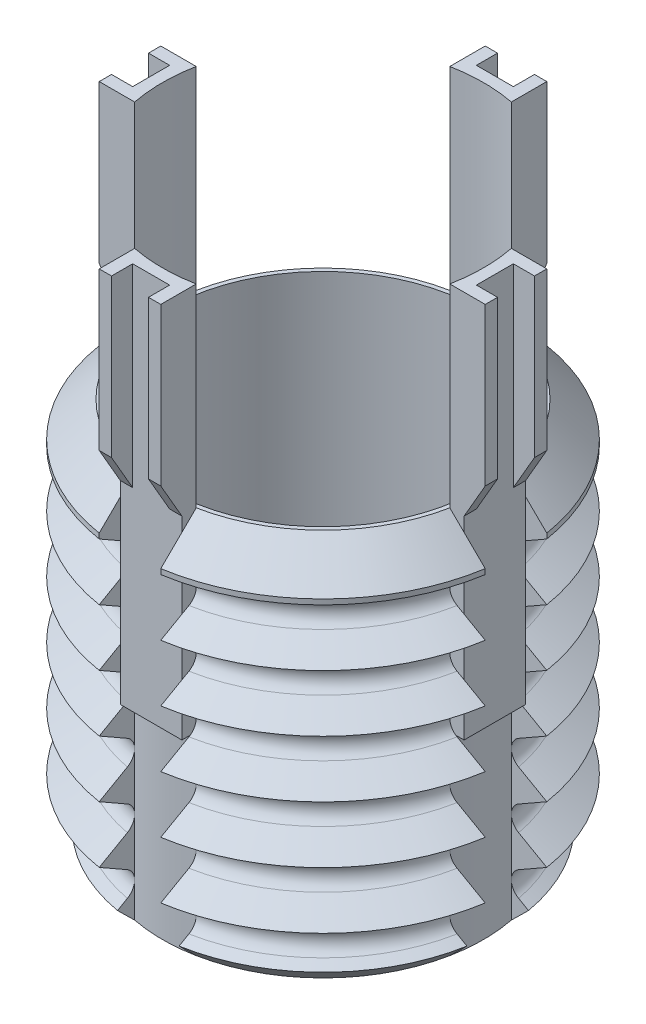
SolidWorks part; units mm, degrees
ref_plane "Front Plane" through (0, 0, 0) normal (0, 0, 1) x (1, 0, 0)
ref_plane "Top Plane" through (0, 0, 0) normal (0, 1, 0) x (1, 0, 0)
ref_plane "Right Plane" through (0, 0, 0) normal (1, 0, 0) x (0, 0, -1)
sketch "Sketch1" plane through (0, 0, 0) normal (0, 1, 0) x (1, 0, 0)
  circle A0 centre (0, 0) radius 7.9375
  circle A1 centre (0, 0) radius 6.35
  dimension "D1" = 12.7
  dimension "D2" = 15.875
extrude "Boss-Extrude1" add sketch "Sketch1" along normal mid plane 15.75
sketch "Sketch2" plane through (0, 7.875, 0) normal (0, 1, 0) x (1, 0, 0)
  circle A0 centre (0, 0) radius 6.52
  dimension "D1" = 13.04
extrude "Cut-Extrude1" cut sketch "Sketch2" against normal through all draft 45 flip side to cut
mirror "Mirror1" about plane through (0, 0, 0) normal (0, 1, 0) of "Cut-Extrude1"
sketch "Sketch3" plane through (0, 7.875, 0) normal (0, 1, 0) x (1, 0, 0)
  line L0 (-7.9375, 0) -> (-7.9375, 1.25)
  line L1 (-7.9375, 1.25) -> (-6.3991, 1.25)
  line L2 (-7.9375, 0) -> (-7.9375, -1.25)
  line L3 (-7.9375, -1.25) -> (-6.3991, -1.25)
  arc A0 (-6.3991, 1.25) -> (-6.3991, -1.25) centre (0, 0) ccw
  circle A1 centre (0, 0) radius 6.52 construction
  circle A2 centre (0, 0) radius 7.9375 construction
  dimension "D1" = 2.5
extrude "Cut-Extrude2" cut sketch "Sketch3" against normal through all
sketch "Sketch4" plane through (0, 0, 0) normal (0, 0, 1) x (1, 0, 0)
  line L1 (7.9375, -6.4575) -> (7.9375, -7.6125)
  line L3 (7.9375, -7.6125) -> (6.8115, -6.9624)
  line L6 (6.8115, -5.9526) -> (7.9375, -5.3025)
  line L10 (7.9375, -6.4575) -> (7.9375, 6.4575) construction
  line L12 (7.9375, -5.3025) -> (7.9375, -6.4575)
  arc A1 (6.8115, -6.9624) -> (6.8115, -5.9526) centre (7.103, -6.4575) cw
  point P5 (6.52, -7.875)
  point P9 (6.52, -6.4575)
  dimension "D2" = 60
  dimension "D1" = 2.31
revolve "Cut-Revolve1" cut sketch "Sketch4" angle 360 about axis through (0, 7.875, 0) along (0, -1, 0)
pattern_linear "LPattern1" count 6 spacing 2.31 along (0, 1, 0) of "Cut-Revolve1"
sketch "Sketch5" plane through (0, 7.875, 0) normal (0, -1, 0) x (1, 0, 0)
  line L0 (-6.3991, 1.25) -> (-7.8385, 1.25)
  line L1 (-6.3991, -1.25) -> (-7.8385, -1.25)
  line L2 (-6.9798, -0.75) -> (-7.8385, -0.75)
  line L3 (-6.9798, 0.75) -> (-7.8385, 0.75)
  line L4 (-7.8385, 1.25) -> (-7.8385, 0.75)
  line L5 (-7.8385, -0.75) -> (-7.8385, -1.25)
  line L6 (-6.9798, 0.75) -> (-6.9798, -0.75)
  arc A0 (-6.3991, 1.25) -> (-6.3991, -1.25) centre (0, 0) ccw
  arc A1 (-6.3991, 1.25) -> (-6.3991, -1.25) centre (0, 0) ccw construction
  arc A3 (-6.9798, 0.75) -> (-6.9798, -0.75) centre (0, 0) ccw construction
  dimension "D1" = 0.5
extrude "Boss-Extrude2" add sketch "Sketch5" along normal mid plane 15.75
sketch "Sketch6" plane through (0, 0, 0) normal (0, 0, 1) x (1, 0, 0)
  line L9 (-6.9798, 7.875) -> (-7.8385, 9.3622)
  line L10 (-6.9798, 0) -> (-6.9798, 15.75) construction
  line L11 (-7.8385, 0) -> (-7.8385, 15.75) construction
  line L12 (-7.8385, 9.3622) -> (-7.8385, 0)
  line L13 (-7.8385, 0) -> (-6.9798, 0)
  line L15 (-6.9798, 0) -> (-6.9798, 7.875)
  line L16 (6.35, 7.875) -> (-6.35, 7.875) construction
  dimension "D1" = 150
extrude "Cut-Extrude3" cut sketch "Sketch6" against normal mid plane 2.5
pattern_circular "CirPattern1" count 4 over 360 about axis through (0, 0, 0) along (0, 1, 0) of "Cut-Extrude2", "Boss-Extrude2", "Cut-Extrude3"
